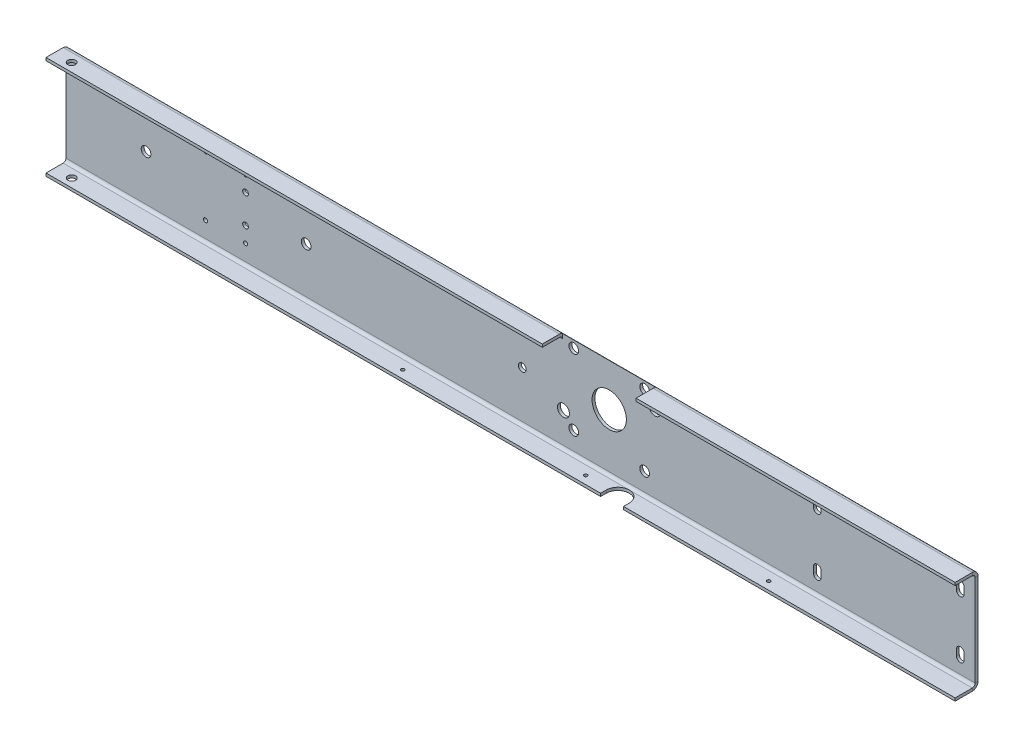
SolidWorks part; units mm, degrees
ref_plane "Plan de face" through (0, 0, 0) normal (0, 0, 1) x (1, 0, 0)
ref_plane "Plan de dessus" through (0, 0, 0) normal (0, 1, 0) x (1, 0, 0)
ref_plane "Plan de droite" through (0, 0, 0) normal (1, 0, 0) x (0, 0, -1)
mirrored part "DF030477_Rendre symétrique"
other "<DF030477>-<Enlèv. mat.-Extru.5>"
